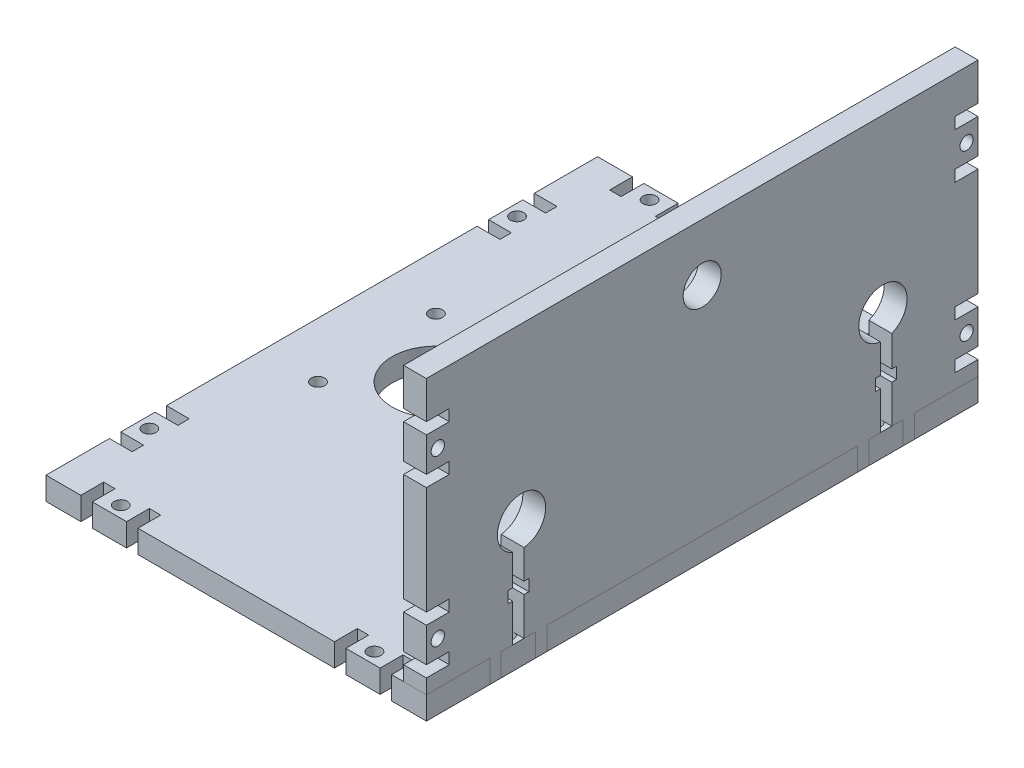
SolidWorks part; units mm, degrees
ref_plane "Front Plane" through (0, 0, 0) normal (0, 0, 1) x (1, 0, 0)
ref_plane "Top Plane" through (0, 0, 0) normal (0, 1, 0) x (1, 0, 0)
ref_plane "Right Plane" through (0, 0, 0) normal (1, 0, 0) x (0, 0, -1)
sketch "Sketch1" plane through (0, 0, 0) normal (0, 1, 0) x (1, 0, 0)
  line L1 (-50, -72.5) -> (50, -72.5)
  line L2 (-50, -72.5) -> (-50, 72.5)
  line L3 (-50, 72.5) -> (50, 72.5)
  line L4 (50, -72.5) -> (50, 72.5)
  line L5 (-50, -72.5) -> (50, 72.5) construction
  line L6 (-50, 72.5) -> (50, -72.5) construction
  point P0 (0, 0)
  dimension "D1" = 100
  dimension "D2" = 145
extrude "Boss-Extrude1" add sketch "Sketch1" along normal blind 6
sketch "Sketch2" plane through (0, 6, 0) normal (0, 1, 0) x (1, 0, 0)
  line L0 (50, 69.5) -> (-50, 69.5) construction
  line L1 (-50, -69.5) -> (50, -69.5) construction
  line L2 (-47, 72.5) -> (-47, -72.5) construction
  line L3 (50, 66.5) -> (-50, 66.5) construction
  line L4 (47, -72.5) -> (47, 72.5) construction
  line L5 (-44, 72.5) -> (-44, -72.5) construction
  line L6 (44, -72.5) -> (44, 72.5) construction
  line L7 (-50, -66.5) -> (50, -66.5) construction
  line L12 (50, -72.5) -> (50, 72.5)
  line L13 (50, 72.5) -> (-50, 72.5)
  line L14 (-50, 72.5) -> (-50, -72.5)
  line L15 (-50, -72.5) -> (50, -72.5)
  line L16 (50, -72.5) -> (50, 72.5) construction
  line L17 (50, 72.5) -> (-50, 72.5) construction
  line L18 (-50, 72.5) -> (-50, -72.5) construction
  line L19 (-50, -72.5) -> (50, -72.5) construction
  line L21 (-50, 55.8333) -> (-44, 55.8333)
  line L22 (-50, 55.8333) -> (-50, 52.8333)
  line L23 (-50, 52.8333) -> (-44, 52.8333)
  line L24 (-44, 55.8333) -> (-44, 52.8333)
  line L25 (-33.3333, 69.5) -> (-33.3333, 66.5) construction
  line L26 (-40.8333, 66.5) -> (-37.8333, 66.5)
  line L27 (-40.8333, 66.5) -> (-40.8333, 72.5)
  line L28 (-40.8333, 72.5) -> (-37.8333, 72.5)
  line L29 (-37.8333, 66.5) -> (-37.8333, 72.5)
  line L30 (-47, 48.3333) -> (-44, 48.3333) construction
  line L31 (0, 72.5) -> (0, 0) construction
  line L32 (0, 0) -> (-50, 0) construction
  line L33 (-25.8333, 72.5) -> (-28.8333, 72.5)
  line L34 (-28.8333, 66.5) -> (-28.8333, 72.5)
  line L35 (-25.8333, 66.5) -> (-28.8333, 66.5)
  line L36 (-25.8333, 66.5) -> (-25.8333, 72.5)
  line L37 (-50, 43.8333) -> (-44, 43.8333)
  line L38 (-44, 40.8333) -> (-44, 43.8333)
  line L39 (-50, 40.8333) -> (-44, 40.8333)
  line L40 (-50, 40.8333) -> (-50, 43.8333)
  line L41 (50, 40.8333) -> (50, 43.8333)
  line L42 (50, 40.8333) -> (44, 40.8333)
  line L43 (44, 40.8333) -> (44, 43.8333)
  line L44 (50, 43.8333) -> (44, 43.8333)
  line L45 (50, 52.8333) -> (44, 52.8333)
  line L46 (44, 55.8333) -> (44, 52.8333)
  line L47 (50, 55.8333) -> (44, 55.8333)
  line L48 (50, 55.8333) -> (50, 52.8333)
  line L49 (40.8333, 72.5) -> (37.8333, 72.5)
  line L50 (37.8333, 66.5) -> (37.8333, 72.5)
  line L51 (40.8333, 66.5) -> (37.8333, 66.5)
  line L52 (40.8333, 66.5) -> (40.8333, 72.5)
  line L53 (25.8333, 66.5) -> (25.8333, 72.5)
  line L54 (25.8333, 66.5) -> (28.8333, 66.5)
  line L55 (28.8333, 66.5) -> (28.8333, 72.5)
  line L56 (25.8333, 72.5) -> (28.8333, 72.5)
  line L57 (50, -40.8333) -> (44, -40.8333)
  line L58 (44, -40.8333) -> (44, -43.8333)
  line L59 (50, -43.8333) -> (44, -43.8333)
  line L60 (50, -40.8333) -> (50, -43.8333)
  line L61 (50, -55.8333) -> (50, -52.8333)
  line L62 (50, -55.8333) -> (44, -55.8333)
  line L63 (44, -55.8333) -> (44, -52.8333)
  line L64 (50, -52.8333) -> (44, -52.8333)
  line L65 (40.8333, -66.5) -> (40.8333, -72.5)
  line L66 (40.8333, -66.5) -> (37.8333, -66.5)
  line L67 (37.8333, -66.5) -> (37.8333, -72.5)
  line L68 (40.8333, -72.5) -> (37.8333, -72.5)
  line L69 (25.8333, -66.5) -> (28.8333, -66.5)
  line L70 (28.8333, -66.5) -> (28.8333, -72.5)
  line L71 (25.8333, -72.5) -> (28.8333, -72.5)
  line L72 (25.8333, -66.5) -> (25.8333, -72.5)
  line L73 (-50, -40.8333) -> (-50, -43.8333)
  line L74 (-50, -40.8333) -> (-44, -40.8333)
  line L75 (-44, -40.8333) -> (-44, -43.8333)
  line L76 (-50, -43.8333) -> (-44, -43.8333)
  line L77 (-50, -52.8333) -> (-44, -52.8333)
  line L78 (-44, -55.8333) -> (-44, -52.8333)
  line L79 (-50, -55.8333) -> (-44, -55.8333)
  line L80 (-50, -55.8333) -> (-50, -52.8333)
  line L81 (-40.8333, -72.5) -> (-37.8333, -72.5)
  line L82 (-37.8333, -66.5) -> (-37.8333, -72.5)
  line L83 (-40.8333, -66.5) -> (-37.8333, -66.5)
  line L84 (-40.8333, -66.5) -> (-40.8333, -72.5)
  line L85 (-25.8333, -66.5) -> (-25.8333, -72.5)
  line L86 (-25.8333, -66.5) -> (-28.8333, -66.5)
  line L87 (-28.8333, -66.5) -> (-28.8333, -72.5)
  line L88 (-25.8333, -72.5) -> (-28.8333, -72.5)
  circle A0 centre (-33.3333, 69.5) radius 1.75
  circle A1 centre (-47, 48.3333) radius 1.75
  circle A2 centre (47, 48.3333) radius 1.75
  circle A3 centre (33.3333, 69.5) radius 1.75
  circle A4 centre (47, -48.3333) radius 1.75
  circle A5 centre (33.3333, -69.5) radius 1.75
  circle A6 centre (-47, -48.3333) radius 1.75
  circle A7 centre (-33.3333, -69.5) radius 1.75
  point P38 (-39.3333, 66.5)
  point P39 (-44, 54.3333)
extrude "Cut-Extrude1" cut sketch "Sketch2" against normal through all
sketch "Sketch3" plane through (0, 6, 0) normal (0, 1, 0) x (1, 0, 0)
  line L0 (0, 0) -> (-20, 0) construction
  line L2 (-35.5, -15.5) -> (-4.5, -15.5) construction
  line L3 (-35.5, -15.5) -> (-35.5, 15.5) construction
  line L4 (-35.5, 15.5) -> (-4.5, 15.5) construction
  line L5 (-4.5, -15.5) -> (-4.5, 15.5) construction
  line L6 (-35.5, -15.5) -> (-4.5, 15.5) construction
  line L7 (-35.5, 15.5) -> (-4.5, -15.5) construction
  circle A0 centre (-20, 0) radius 11.5
  circle A1 centre (-4.5, 15.5) radius 1.75
  circle A2 centre (-35.5, 15.5) radius 1.75
  circle A3 centre (-35.5, -15.5) radius 1.75
  circle A4 centre (-4.5, -15.5) radius 1.75
  dimension "D1" = 31
  dimension "D2" = 23
  dimension "D4" = 3.5
  dimension "D3" = 20
extrude "Cut-Extrude2" cut sketch "Sketch3" against normal through all
sketch "Sketch4" plane through (44, 0, 0) normal (1, 0, 0) x (0, 0, -1)
  line L0 (-72.5, 6) -> (-55.8333, 6)
  line L1 (-55.8333, 6) -> (-55.8333, 0)
  line L2 (-55.8333, 0) -> (-52.8333, 0)
  line L3 (-52.8333, 0) -> (-52.8333, 6)
  line L4 (-52.8333, 6) -> (-43.8333, 6)
  line L5 (-43.8333, 6) -> (-43.8333, 0)
  line L6 (-43.8333, 0) -> (-40.8333, 0)
  line L7 (-40.8333, 0) -> (-40.8333, 6)
  line L8 (-40.8333, 6) -> (40.8333, 6)
  line L9 (40.8333, 6) -> (40.8333, 0)
  line L10 (40.8333, 0) -> (43.8333, 0)
  line L11 (43.8333, 0) -> (43.8333, 6)
  line L12 (43.8333, 6) -> (52.8333, 6)
  line L13 (52.8333, 6) -> (52.8333, 0)
  line L14 (52.8333, 0) -> (55.8333, 0)
  line L15 (55.8333, 0) -> (55.8333, 6)
  line L16 (55.8333, 6) -> (72.5, 6)
  line L17 (72.5, 6) -> (72.5, 78)
  line L18 (72.5, 78) -> (-72.5, 78)
  line L19 (-72.5, 78) -> (-72.5, 6)
  line L20 (-40.8333, 0) -> (40.8333, 0) construction
  dimension "D1" = 78
extrude "Boss-Extrude2" add sketch "Sketch4" along normal blind 6 separate body
sketch "Sketch5" plane through (50, 0, 0) normal (1, 0, 0) x (0, 0, -1)
  line L0 (-66.5, 78) -> (-66.5, 0) construction
  line L1 (72.5, 78) -> (-72.5, 78) construction
  line L2 (-66.5, 0) -> (0, 0) construction
  line L3 (-72.5, 78) -> (-72.5, 6) construction
  line L4 (-69.5, 78) -> (-69.5, 0) construction
  line L5 (-69.5, 60.6667) -> (-66.5, 60.6667) construction
  line L6 (-72.5, 68.1667) -> (-66.5, 68.1667)
  line L7 (-72.5, 68.1667) -> (-72.5, 65.1667)
  line L8 (-72.5, 65.1667) -> (-66.5, 65.1667)
  line L9 (-66.5, 68.1667) -> (-66.5, 65.1667)
  line L10 (-72.5, 56.1667) -> (-66.5, 56.1667)
  line L11 (-66.5, 53.1667) -> (-66.5, 56.1667)
  line L12 (-72.5, 53.1667) -> (-66.5, 53.1667)
  line L13 (-72.5, 53.1667) -> (-72.5, 56.1667)
  line L14 (-66.5, 39) -> (72.5, 39) construction
  line L15 (0, 0) -> (0, 78) construction
  line L16 (72.5, 6) -> (72.5, 78) construction
  line L17 (-72.5, 24.8333) -> (-72.5, 21.8333)
  line L18 (-72.5, 24.8333) -> (-66.5, 24.8333)
  line L19 (-66.5, 24.8333) -> (-66.5, 21.8333)
  line L20 (-72.5, 21.8333) -> (-66.5, 21.8333)
  line L21 (-72.5, 12.8333) -> (-66.5, 12.8333)
  line L22 (-66.5, 9.8333) -> (-66.5, 12.8333)
  line L23 (-72.5, 9.8333) -> (-66.5, 9.8333)
  line L24 (-72.5, 9.8333) -> (-72.5, 12.8333)
  line L25 (72.5, 9.8333) -> (72.5, 12.8333)
  line L26 (72.5, 9.8333) -> (66.5, 9.8333)
  line L27 (66.5, 9.8333) -> (66.5, 12.8333)
  line L28 (72.5, 12.8333) -> (66.5, 12.8333)
  line L29 (72.5, 21.8333) -> (66.5, 21.8333)
  line L30 (66.5, 24.8333) -> (66.5, 21.8333)
  line L31 (72.5, 24.8333) -> (66.5, 24.8333)
  line L32 (72.5, 24.8333) -> (72.5, 21.8333)
  line L33 (72.5, 53.1667) -> (72.5, 56.1667)
  line L34 (72.5, 53.1667) -> (66.5, 53.1667)
  line L35 (66.5, 53.1667) -> (66.5, 56.1667)
  line L36 (72.5, 56.1667) -> (66.5, 56.1667)
  line L37 (66.5, 68.1667) -> (66.5, 65.1667)
  line L38 (72.5, 65.1667) -> (66.5, 65.1667)
  line L39 (72.5, 68.1667) -> (72.5, 65.1667)
  line L40 (72.5, 68.1667) -> (66.5, 68.1667)
  circle A0 centre (-69.5, 60.6667) radius 1.75
  circle A1 centre (-69.5, 17.3333) radius 1.75
  circle A2 centre (69.5, 17.3333) radius 1.75
  circle A3 centre (69.5, 60.6667) radius 1.75
  point P17 (-66.5, 66.6667)
extrude "Cut-Extrude3" cut sketch "Sketch5" against normal through all
sketch "Sketch6" plane through (50, 0, 0) normal (1, 0, 0) x (0, 0, -1)
  line L0 (0, 78) -> (0, 63) construction
  line L1 (72.5, 78) -> (-72.5, 78) construction
  line L2 (0, 63) -> (0, 33) construction
  line L3 (47.5, 33) -> (-47.5, 33) construction
  circle A0 centre (0, 63) radius 5
  circle A1 centre (47.5, 33) radius 6.35
  circle A2 centre (-47.5, 33) radius 6.35
  point P9 (0, 33)
  dimension "D4" = 10
  dimension "D5" = 12.7
  dimension "D1" = 95
  dimension "D2" = 30
  dimension "D3" = 15
extrude "Cut-Extrude4" cut sketch "Sketch6" against normal through all
sketch "Sketch7" plane through (50, 0, 0) normal (1, 0, 0) x (0, 0, -1)
  line L0 (-48.3333, 30) -> (-48.3333, 6) construction
  line L1 (-49.8333, 6) -> (-46.8333, 6)
  line L2 (-49.8333, 6) -> (-49.8333, 16)
  line L4 (-46.8333, 6) -> (-46.8333, 16)
  line L5 (-51.0892, 19) -> (-49.8333, 19)
  line L6 (-51.0892, 19) -> (-51.0892, 16)
  line L7 (-51.0892, 16) -> (-49.8333, 16)
  line L8 (-45.5774, 19) -> (-45.5774, 16)
  line L9 (-49.8333, 30) -> (-46.8333, 30)
  line L10 (-49.8333, 30) -> (-49.8333, 19)
  line L12 (-46.8333, 30) -> (-46.8333, 19)
  line L13 (-46.8333, 19) -> (-45.5774, 19)
  line L14 (-46.8333, 16) -> (-45.5774, 16)
  line L15 (-52.8333, 6) -> (-43.8333, 6) construction
  line L16 (-55.8333, 0) -> (-52.8333, 0) construction
  line L17 (0, 0) -> (0, 78) construction
  line L18 (72.5, 78) -> (-72.5, 78) construction
  line L19 (48.3333, 30) -> (48.3333, 6) construction
  line L20 (46.8333, 16) -> (45.5774, 16)
  line L21 (46.8333, 19) -> (45.5774, 19)
  line L22 (46.8333, 30) -> (46.8333, 19)
  line L23 (49.8333, 30) -> (49.8333, 19)
  line L24 (49.8333, 30) -> (46.8333, 30)
  line L25 (45.5774, 19) -> (45.5774, 16)
  line L26 (51.0892, 16) -> (49.8333, 16)
  line L27 (51.0892, 19) -> (51.0892, 16)
  line L28 (51.0892, 19) -> (49.8333, 19)
  line L29 (46.8333, 6) -> (46.8333, 16)
  line L30 (49.8333, 6) -> (49.8333, 16)
  line L31 (49.8333, 6) -> (46.8333, 6)
  dimension "D1" = 3
  dimension "D2" = 3
  dimension "D3" = 3
  dimension "D4" = 5.5118
  dimension "D5" = 10
  dimension "D6" = 30
extrude "Cut-Extrude5" cut sketch "Sketch7" against normal through all
equation "\"D14@Sketch2\"=(\"D12@Sketch2\"/3)/2"
equation "\"D16@Sketch2\"=\"D15@Sketch2\""
equation "\"D17@Sketch2\"=(\"D13@Sketch2\"/3)/2"
equation "\"D6@Sketch5\"=(\"D7@Sketch5\"/3)/1.5"
